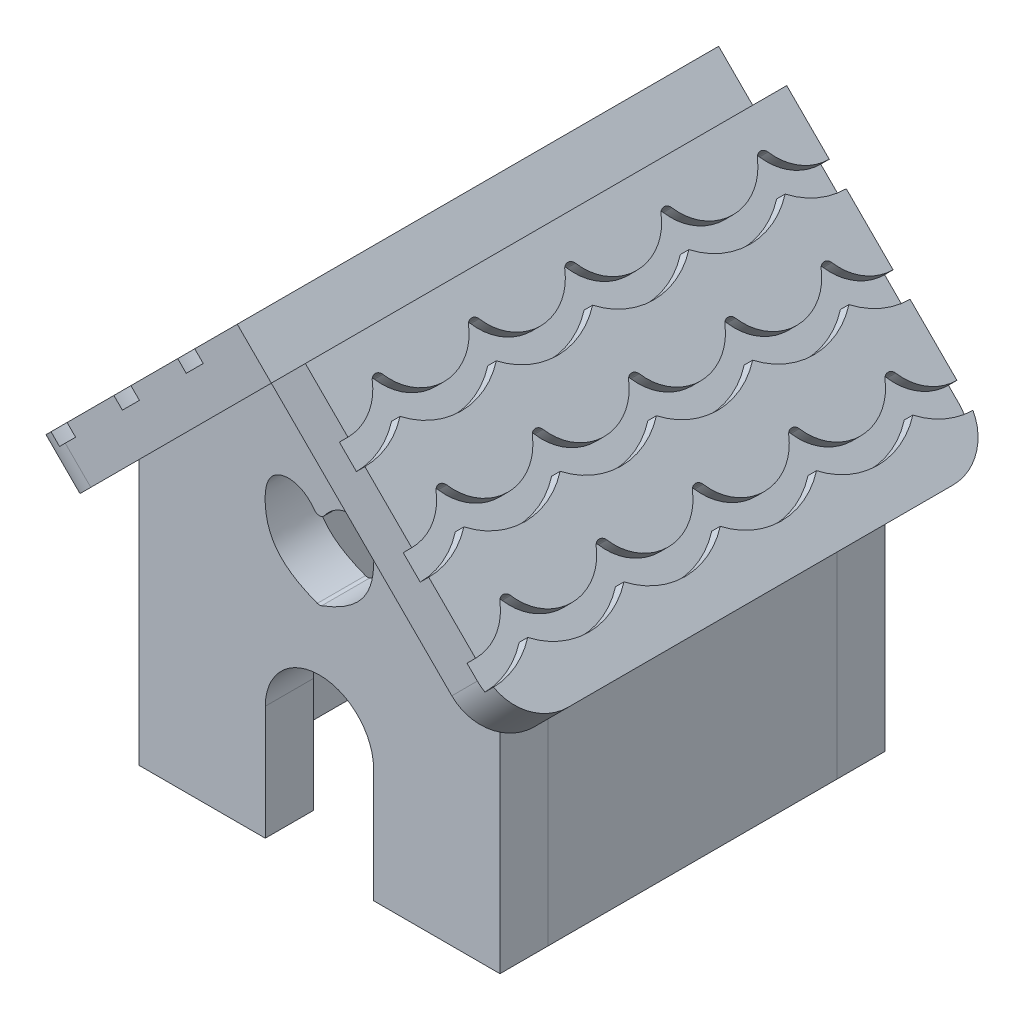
SolidWorks part; units mm, degrees
ref_plane "Front Plane" through (0, 0, 0) normal (0, 0, 1) x (1, 0, 0)
ref_plane "Top Plane" through (0, 0, 0) normal (0, 1, 0) x (1, 0, 0)
ref_plane "Right Plane" through (0, 0, 0) normal (1, 0, 0) x (0, 0, -1)
sketch "Sketch1" plane through (0, 0, 0) normal (0, 0, 1) x (1, 0, 0)
  line L1 (-15, 0) -> (-15, 22)
  line L2 (-15, 22) -> (0, 37)
  line L3 (0, 37) -> (15, 22)
  line L4 (15, 22) -> (15, 0)
  line L5 (-15, 0) -> (-4.5, 0)
  line L6 (-4.5, 0) -> (-4.5, 14)
  line L7 (-4.5, 14) -> (4.5, 14)
  line L8 (4.5, 14) -> (4.5, 0)
  line L9 (4.5, 0) -> (15, 0)
  point P12 (0, 14)
  point P13 (-9.75, 0)
  dimension "D1" = 30
  dimension "D2" = 22
  dimension "D3" = 9
  dimension "D4" = 14
extrude "Boss-Extrude1" add sketch "Sketch1" along normal blind 4
fillet "Fillet1" radius 4.5 2 edges at (4.5, 14, 2) (-4.5, 14, 2)
sketch "Sketch2" plane through (15, 0, 0) normal (1, 0, 0) x (0, 0, -1)
  line L0 (-4, 22) -> (0, 22) construction
  line L1 (0, 0) -> (24, 0)
  line L2 (0, 0) -> (0, 22)
  line L3 (0, 22) -> (24, 22)
  line L4 (24, 0) -> (24, 22)
  dimension "D1" = 24
extrude "Boss-Extrude2" add sketch "Sketch2" against normal blind 4 separate body
sketch "Sketch3" plane through (0, 0, -24) normal (0, 0, -1) x (-1, 0, 0)
  line L9 (-15, 0) -> (-4.5, 0)
  line L10 (-4.5, 0) -> (-4.5, 9.5)
  line L12 (4.5, 9.5) -> (4.5, 0)
  line L13 (4.5, 0) -> (15, 0)
  line L14 (15, 0) -> (15, 22)
  line L15 (15, 22) -> (0, 37)
  line L16 (0, 37) -> (-15, 22)
  line L17 (-15, 22) -> (-15, 0)
  line L18 (-15, 0) -> (-4.5, 0)
  line L19 (-4.5, 0) -> (-4.5, 9.5)
  line L21 (4.5, 9.5) -> (4.5, 0)
  line L22 (4.5, 0) -> (15, 0)
  line L23 (15, 0) -> (15, 22)
  line L24 (15, 22) -> (0, 37)
  line L25 (0, 37) -> (-15, 22)
  line L26 (-15, 22) -> (-15, 0)
  arc A2 (0, 14) -> (-4.5, 9.5) centre (0, 9.5) ccw
  arc A3 (0, 14) -> (-4.5, 9.5) centre (0, 9.5) ccw
  arc A4 (4.5, 9.5) -> (0, 14) centre (0, 9.5) ccw
  arc A5 (4.5, 9.5) -> (0, 14) centre (0, 9.5) ccw
  dimension "D1" = 0
extrude "Boss-Extrude3" add sketch "Sketch3" along normal blind 4 separate body
sketch "Sketch4" plane through (-15, 0, 0) normal (-1, 0, 0) x (0, 0, 1)
  line L4 (0, 0) -> (0, 22)
  line L5 (0, 22) -> (-24, 22)
  line L6 (-24, 22) -> (-24, 0)
  line L7 (-24, 0) -> (0, 0)
  line L8 (0, 0) -> (0, 22)
  line L9 (0, 22) -> (-24, 22)
  line L10 (-24, 22) -> (-24, 0)
  line L11 (-24, 0) -> (0, 0)
  dimension "D1" = 0
extrude "Boss-Extrude4" add sketch "Sketch4" against normal blind 4 separate body
sketch "Sketch5" plane through (-18.5, 18.5, 0) normal (-0.7071, 0.7071, 0) x (0, 0, 1)
  line L0 (4, 26.163) -> (0, 26.163) construction
  line L1 (-32, 26.163) -> (8, 26.163)
  line L2 (-32, 26.163) -> (-32, 0.9497)
  line L3 (-32, 0.9497) -> (8, 0.9497)
  line L4 (8, 26.163) -> (8, 0.9497)
  line L5 (-28, 4.9497) -> (-24, 4.9497) construction
  line L6 (-28, 4.9497) -> (-28, 26.163) construction
  line L7 (0, 4.9497) -> (-24, 4.9497) construction
  point P12 (-12, 4.9497)
  point P13 (-12, 26.163)
extrude "Boss-Extrude5" add sketch "Sketch5" along normal blind 4 separate body
sketch "Sketch8" plane through (0, 0, 4) normal (0, 0, 1) x (1, 0, 0)
  line L0 (0, 0) -> (0, 37) construction
  spline S0 degree 3 poles (0, 25) (1.041, 27.0922) (4.3219, 27.2503) (4.8089, 22.4975) (3.2969, 20.2) (0, 19) knots 0 0 0 0 0.271949 0.488755 1 1 1 1
  spline S1 degree 3 poles (0, 25) (-1.041, 27.0922) (-4.3219, 27.2503) (-4.8089, 22.4975) (-3.2969, 20.2) (0, 19) knots 0 0 0 0 0.271949 0.488755 1 1 1 1
  dimension "D1" = 12
  dimension "D2" = 6
  dimension "D3" = 9
  dimension "D4" = 7.5
  dimension "D5" = 1.5
  dimension "D6" = 1
extrude "Cut-Extrude1" cut sketch "Sketch8" against normal through all
fillet "Fillet4" radius 0.5 2 edges at (0, 19, 2) (0, 25, 2)
fillet "Fillet5" radius 0.5 2 edges at (0, 19, -26) (0, 25, -26)
fillet "Fillet2" radius 4 2 edges at (-19.2426, 20.5858, 8) (-19.2426, 20.5858, -32)
sketch "Sketch11" plane through (-21.3284, 21.3284, 0) normal (-0.7071, 0.7071, 0) x (0, 0, 1)
  line L0 (-32, 26.163) -> (-32, 4.9497) construction
  arc A0 (-36, 25.163) -> (-28, 25.163) centre (-32, 25.163) ccw
  arc A1 (-28, 25.163) -> (-20, 25.163) centre (-24, 25.163) ccw
  arc A2 (-20, 25.163) -> (-12, 25.163) centre (-16, 25.163) ccw
  arc A3 (-12, 25.163) -> (-4, 25.163) centre (-8, 25.163) ccw
  arc A4 (-4, 25.163) -> (4.0001, 25.163) centre (0.0001, 25.163) ccw
  arc A5 (4.0001, 25.163) -> (12.0001, 25.163) centre (8.0001, 25.163) ccw
  dimension "D1" = 8
  dimension "D3" = 8
  dimension "D4" = 1
  dimension "D2" = 6
extrude "Cut-Extrude-Thin6" cut sketch "Sketch11" against normal blind 1 thin
fillet "Fillet3" radius 0.5 5 edges at (-3.182, 38.7678, 4.0001) (-3.182, 38.7678, -4) (-3.182, 38.7678, -12) (-3.182, 38.7678, -20) (-3.182, 38.7678, -28)
pattern_linear "LPattern2" count 3 spacing 7.5 along (-0.7071, -0.7071, 0) of "Cut-Extrude-Thin6", "Fillet3"
mirror "Mirror1" about plane through (0, 0, 0) normal (1, 0, 0)
equation "\"D2@Sketch5\"=\"D1@Sketch5\""
